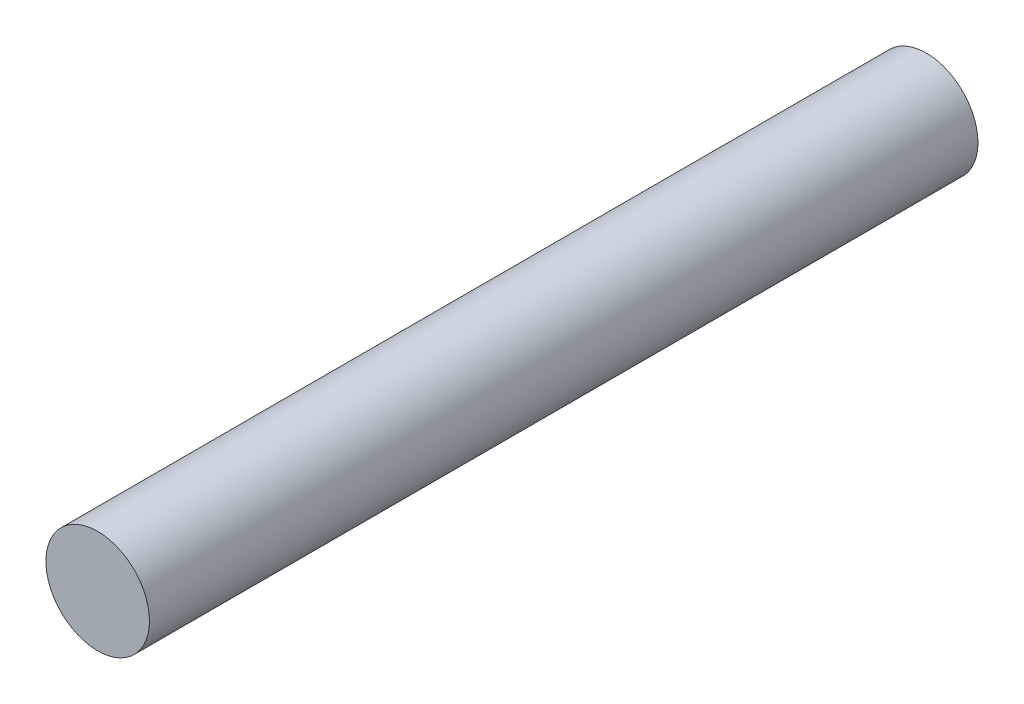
SolidWorks part; units mm, degrees
ref_plane "Front Plane" through (0, 0, 0) normal (0, 0, 1) x (1, 0, 0)
ref_plane "Top Plane" through (0, 0, 0) normal (0, 1, 0) x (1, 0, 0)
ref_plane "Right Plane" through (0, 0, 0) normal (1, 0, 0) x (0, 0, -1)
sketch "Sketch1" plane through (0, 0, 0) normal (0, 0, 1) x (1, 0, 0)
  circle A0 centre (0, 0) radius 1.5875
extrude "Boss-Extrude1" add sketch "Sketch1" along normal mid plane 25.4
equation "\"D_shaft\"= 0.125in"
equation "\"L_shaft\"= 1in"
equation "\"D1@Sketch1@Part2.Part\"= \"D_shaft\""
equation "\"D1@Boss-Extrude1\"= \"L_shaft\""
